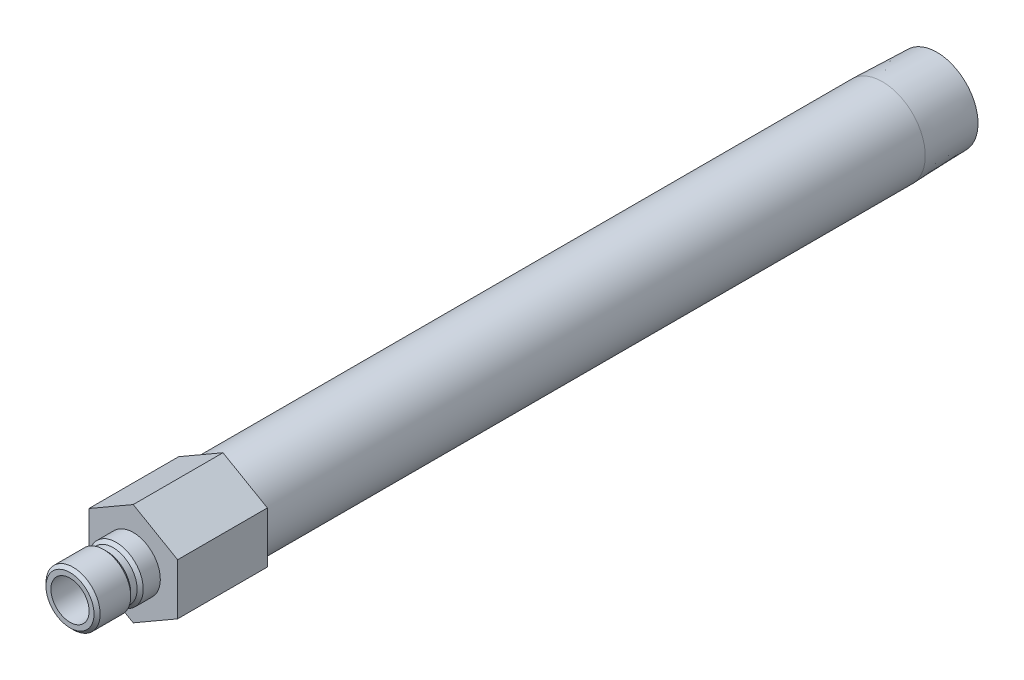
SolidWorks part; units mm, degrees
ref_plane "Front Plane" through (0, 0, 0) normal (0, 0, 1) x (1, 0, 0)
ref_plane "Top Plane" through (0, 0, 0) normal (0, 1, 0) x (1, 0, 0)
ref_plane "Right Plane" through (0, 0, 0) normal (1, 0, 0) x (0, 0, -1)
sketch "Sketch1" plane through (0, 0, 0) normal (1, 0, 0) x (0, 0, -1)
  line L0 (0, 0) -> (-18.923, 0) construction
  line L1 (-15.748, 4.7625) -> (-15.748, 5.9817)
  line L2 (-6.604, 5.9817) -> (-6.604, 0) construction
  line L3 (-14.986, 6.7437) -> (-7.366, 6.7437)
  line L4 (0, 10.668) -> (0, 0) construction
  line L5 (-6.604, 5.9817) -> (-5.0165, 5.9817)
  line L6 (-4.2545, 6.7437) -> (0, 6.7437)
  line L7 (0, 6.7437) -> (0, 10.668)
  line L8 (-6.604, 5.9817) -> (-7.366, 6.7437)
  line L9 (-5.0165, 5.9817) -> (-4.2545, 6.7437)
  line L10 (-15.748, 5.9817) -> (-14.986, 6.7437)
  line L11 (-15.748, 4.7625) -> (22.352, 4.7625)
  line L12 (0, 10.668) -> (186.5884, 10.668)
  line L13 (186.5884, 10.668) -> (200.152, 10.2441)
  line L14 (200.152, 10.2441) -> (200.152, 7.8994)
  line L15 (0, 6.7437) -> (22.352, 6.7437) construction
  line L16 (22.352, 6.7437) -> (22.352, 0) construction
  line L17 (22.352, 0) -> (0, 0) construction
  line L18 (22.352, 4.7625) -> (22.352, 7.8994)
  line L19 (22.352, 7.8994) -> (200.152, 7.8994)
  dimension "D1" = 15.748
  dimension "D2" = 1.5875
  dimension "D3" = 0.762
  dimension "D4" = 45
  dimension "D5" = 9.144
  dimension "D6" = 45
  dimension "D7" = 1.79
  dimension "D8" = 13.5636
  dimension "D9" = 215.9
  dimension "D10" = 3.175
  dimension "D11" = 9.525
  dimension "D12" = 21.336
  dimension "D13" = 38.1
  dimension "D14" = 13.4874
  dimension "D15" = 15.7988
revolve "Revolve1" add sketch "Sketch1" angle 360 about L0
sketch "Sketch2" plane through (0, 0, 0) normal (0, 0, 1) x (1, 0, 0)
  line L1 (-11.049, 6.3791) -> (-11.049, -6.3791)
  line L2 (-11.049, -6.3791) -> (0, -12.7583)
  line L3 (0, -12.7583) -> (11.049, -6.3791)
  line L4 (11.049, -6.3791) -> (11.049, 6.3791)
  line L5 (11.049, 6.3791) -> (0, 12.7583)
  line L6 (0, 12.7583) -> (-11.049, 6.3791)
  circle A0 centre (0, 0) radius 11.049 construction
  circle A1 centre (0, 0) radius 4.7625 construction
  circle A2 centre (0, 0) radius 4.7625
  dimension "D1" = 22.098
extrude "Boss-Extrude1" add sketch "Sketch2" against normal up to vertex (22.352 mm away) from vertex at 0
